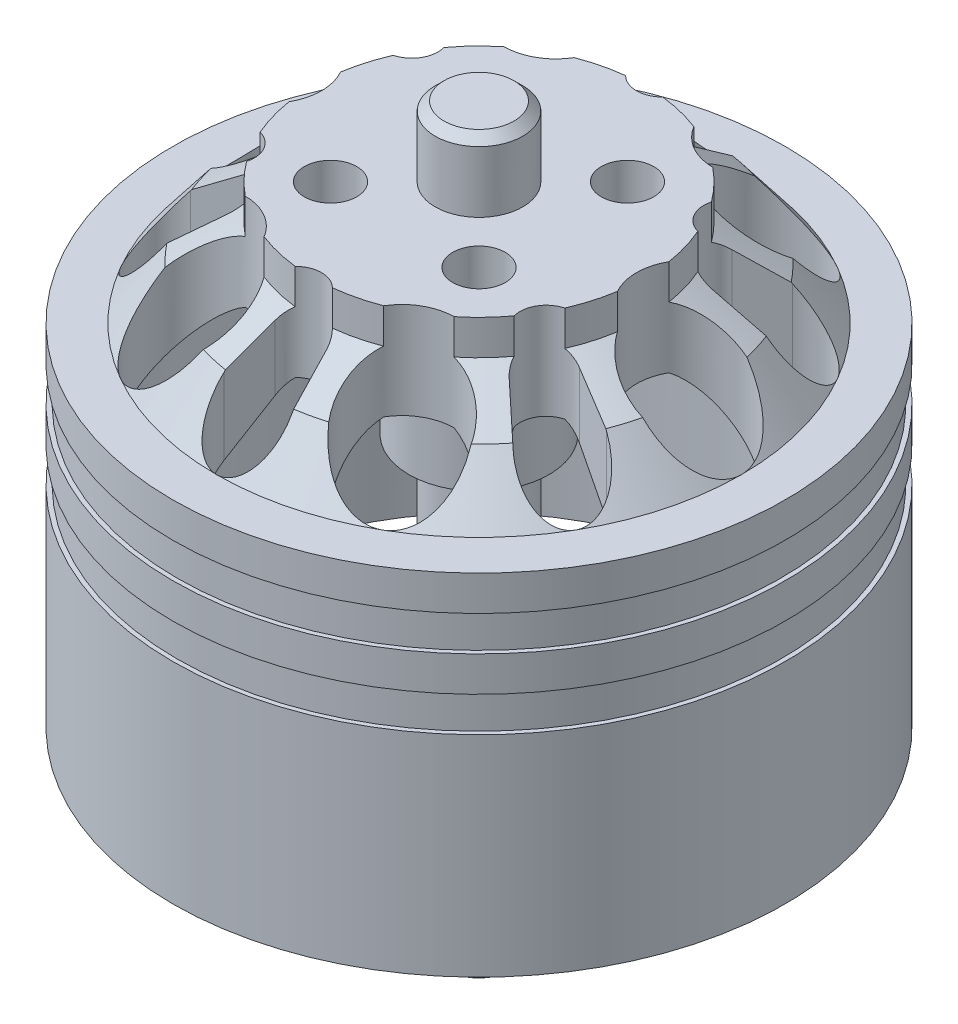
SolidWorks part; units mm, degrees
ref_plane "Front Plane" through (0, 0, 0) normal (0, 0, 1) x (1, 0, 0)
ref_plane "Top Plane" through (0, 0, 0) normal (0, 1, 0) x (1, 0, 0)
ref_plane "Right Plane" through (0, 0, 0) normal (1, 0, 0) x (0, 0, -1)
sketch "Sketch1" plane through (0, 0, 0) normal (0, 0, 1) x (1, 0, 0)
  line L0 (0, 0) -> (0, -64.5969) construction
  line L1 (0, 0) -> (0, 42)
  line L2 (0, 42) -> (2.5, 42)
  line L3 (2.5, 42) -> (2.5, 38)
  line L4 (2.5, 38) -> (9.5, 38)
  line L5 (9.5, 38) -> (9.5, 36)
  line L6 (9.5, 36) -> (12.6908, 33.9849)
  line L7 (12.6908, 33.9849) -> (15, 31)
  line L8 (15, 31) -> (17.5, 31)
  line L9 (17.5, 31) -> (17.5, 29)
  line L10 (17.5, 29) -> (17.25, 29)
  line L11 (17.25, 29) -> (17.25, 27)
  line L12 (17.25, 27) -> (17.5, 27)
  line L13 (17.5, 27) -> (17.5, 25)
  line L14 (17.5, 25) -> (17.25, 25)
  line L15 (17.25, 25) -> (17.25, 23)
  line L16 (17.25, 23) -> (17.5, 23)
  line L17 (17.5, 23) -> (17.5, 11)
  line L18 (17.5, 11) -> (15, 11)
  line L19 (15, 11) -> (15, 28.5)
  line L20 (15, 28.5) -> (13.9, 28.5)
  line L21 (13.9, 28.5) -> (9.5, 32.5)
  line L22 (9.5, 32.5) -> (4, 32.5)
  line L24 (2.5, 0) -> (0, 0)
  line L25 (2.5, 0) -> (2.5, 25.5)
  line L26 (2.5, 25.5) -> (4, 25.5)
  line L27 (4, 25.5) -> (4, 32.5)
  point P26 (0, 0)
  point P28 (4, 29)
  point P29 (0, 0)
  point P30 (0, 0)
  point P32 (0, 0)
  point P33 (4.0827, 31.834)
  point P34 (15.3526, 27.6222)
  point P35 (15.0386, 27.2595)
  point P36 (16.4724, 27.45)
  point P37 (15.5561, 26.4115)
  point P38 (14.2733, 26.381)
  point P39 (14.5628, 24.3662)
  point P40 (9.5, 30.8552)
  point P41 (14.7228, 25.3062)
  point P42 (13.5295, 25.3764)
  point P43 (15, 27.5911)
  point P44 (0, 0)
  point P45 (17.5, 28.6114)
  dimension "D1" = 42
  dimension "D2" = 5
  dimension "D3" = 35
  dimension "D4" = 8
  dimension "D5" = 14.5
  dimension "D6" = 10
  dimension "D7" = 10
  dimension "D8" = 19
  dimension "D9" = 4
  dimension "D10" = 2
  dimension "D11" = 20
  dimension "D12" = 7
  dimension "D13" = 30
  dimension "D14" = 2.5
  dimension "D15" = 4
  dimension "D16" = 0.25
  dimension "D17" = 2
  dimension "D18" = 2
  dimension "D19" = 2
  dimension "D20" = 2
revolve "Revolve1" add sketch "Sketch1" angle 360 about L0
sketch "Sketch3" plane through (0, 38, 0) normal (0, 1, 0) x (1, 0, 0)
  circle A0 centre (12, 0) radius 3
  circle A1 centre (0, 0) radius 15 construction
  circle A2 centre (0, 0) radius 15 construction
  point P5 (0, 0)
  dimension "D1" = 6
extrude "Cut-Extrude1" cut sketch "Sketch3" against normal through all
pattern_circular "CirPattern1" count 6 every 60 about axis through (0, 0, 0) along (0, 1, 0) of "Cut-Extrude1"
sketch "Sketch4" plane through (0, 38, 0) normal (0, 1, 0) x (1, 0, 0)
  line L0 (0, 0) -> (12.9904, 7.5) construction
  line L1 (0, 0) -> (15, 0)
  line L2 (9.5683, 3.8272) -> (11.8917, 4.6029)
  line L3 (8.0986, 6.3728) -> (9.9321, 7.9971)
  arc A0 (15, 0) -> (7.5, 12.9904) centre (0, 0) ccw construction
  circle A1 centre (11.2583, 6.5) radius 2
  circle A2 centre (9.0933, 5.25) radius 1.5
  circle A3 centre (0, 0) radius 9 construction
  arc A4 (9.3854, 1.471) -> (9.3854, -1.471) centre (12, 0) ccw construction
  dimension "D2" = 4
  dimension "D3" = 3
  dimension "D1" = 30
extrude "Cut-Extrude2" cut sketch "Sketch4" against normal through all contours A1 A2 M9 | A1 A2 | A2 A1 | A2 A1 L3 | A2 L2 A1 | A2 M9
pattern_circular "CirPattern2" count 6 every 60 about axis through (0, 0, 0) along (0, 1, 0) of "Cut-Extrude2"
chamfer "Chamfer1" distance 0.5 angle 45 2 edges at (0, 0, 2.5) (0, 42, 2.5)
sketch "Sketch5" plane through (0, 38, 0) normal (0, 1, 0) x (1, 0, 0)
  line L1 (4.2426, -4.2426) -> (-4.2426, -4.2426) construction
  line L2 (4.2426, -4.2426) -> (4.2426, 4.2426) construction
  line L3 (4.2426, 4.2426) -> (-4.2426, 4.2426) construction
  line L4 (-4.2426, -4.2426) -> (-4.2426, 4.2426) construction
  line L5 (4.2426, -4.2426) -> (-4.2426, 4.2426) construction
  line L6 (4.2426, 4.2426) -> (-4.2426, -4.2426) construction
  circle A0 centre (0, 0) radius 6 construction
  circle A1 centre (-4.2426, 4.2426) radius 1.5
  circle A2 centre (-4.2426, -4.2426) radius 1.5
  circle A3 centre (4.2426, -4.2426) radius 1.5
  circle A4 centre (4.2426, 4.2426) radius 1.5
  dimension "D1" = 12
  dimension "D2" = 3
extrude "Cut-Extrude3" cut sketch "Sketch5" against normal blind 10
